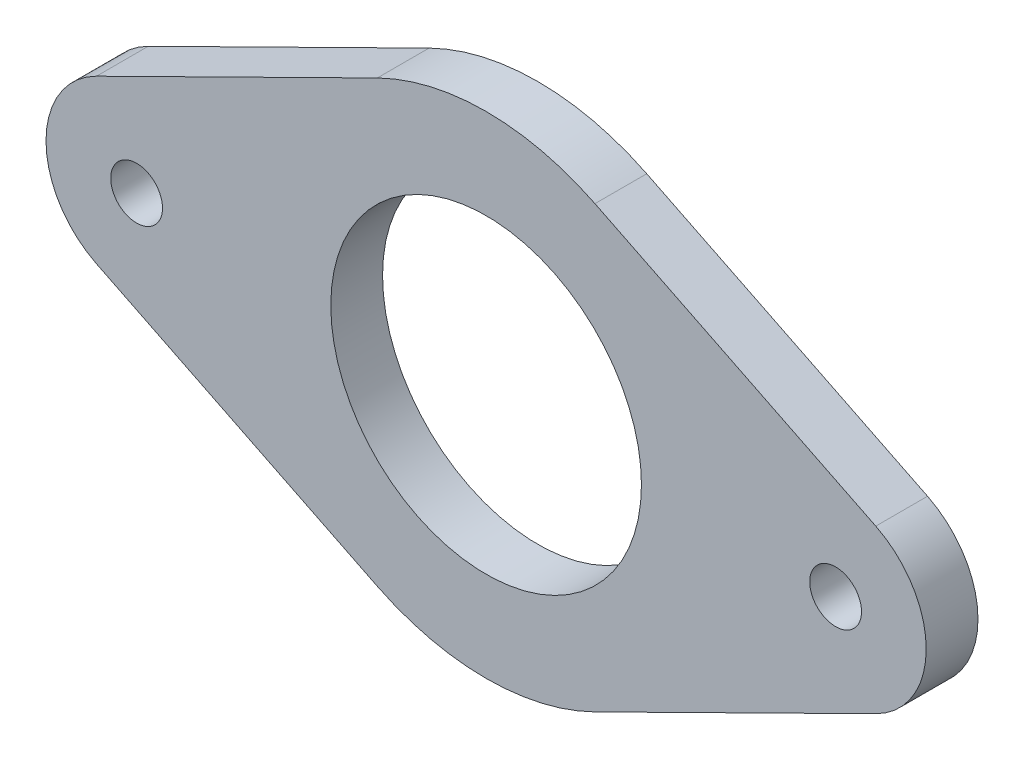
SolidWorks part; units mm, degrees
ref_plane "Plan1" through (0, 0, 0) normal (0, 0, 1) x (1, 0, 0)
ref_plane "Plan2" through (0, 0, 0) normal (0, 1, 0) x (1, 0, 0)
ref_plane "Plan3" through (0, 0, 0) normal (1, 0, 0) x (0, 0, -1)
sketch "Esquisse1" plane through (0, 0, 0) normal (0, 0, 1) x (1, 0, 0)
  line L0 (-31, 0) -> (29, 0) construction
  line L1 (0, 7) -> (0, -5.5) construction
  line L2 (-30.1028, 6.2748) -> (-8.4075, 17.0027)
  line L3 (-30.1028, -6.2748) -> (-8.4075, -17.0027)
  line L4 (30.1028, -6.2748) -> (8.4075, -17.0027)
  line L5 (30.1028, 6.2748) -> (8.4075, 17.0027)
  circle A0 centre (0, 0) radius 12
  arc A1 (-8.4075, -17.0027) -> (8.4075, -17.0027) centre (0, 0) ccw
  circle A3 centre (-27, 0) radius 2
  arc A4 (-30.1028, 6.2748) -> (-30.1028, -6.2748) centre (-27, 0) ccw
  arc A5 (30.1028, 6.2748) -> (30.1028, -6.2748) centre (27, 0) cw
  circle A6 centre (27, 0) radius 2
  arc A7 (8.4075, 17.0027) -> (-8.4075, 17.0027) centre (0, 0) ccw
  dimension "D1" = 24
  dimension "D2" = 4
  dimension "D3" = 54
  dimension "D4" = 7
  dimension "D5" = 18.9678
extrude "Base-Extrusion" add sketch "Esquisse1" along normal blind 4
